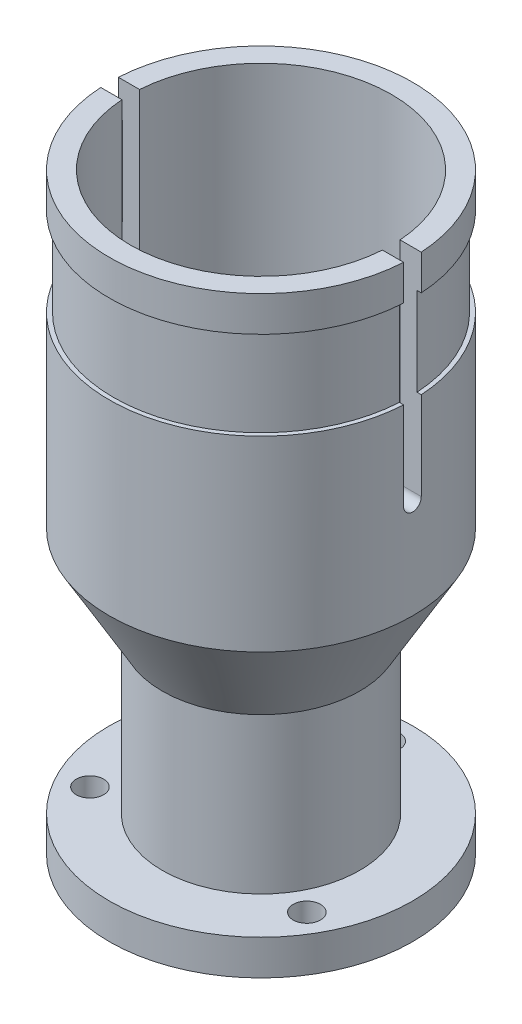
SolidWorks part; units mm, degrees
ref_plane "Front" through (0, 0, 0) normal (0, 0, 1) x (1, 0, 0)
ref_plane "Top" through (0, 0, 0) normal (0, 1, 0) x (1, 0, 0)
ref_plane "Right" through (0, 0, 0) normal (1, 0, 0) x (0, 0, -1)
sketch "Sketch1" plane through (0, 0, 0) normal (0, 0, 1) x (1, 0, 0)
  line L0 (0, 0) -> (0, 86.1729) construction
  line L1 (-27.305, 106.68) -> (-27.305, 100.33)
  line L2 (-27.305, 50.8) -> (-17.78, 34.3022)
  line L3 (-17.78, 34.3022) -> (-17.78, 6.35)
  line L4 (-17.78, 6.35) -> (-27.305, 6.35)
  line L5 (-27.305, 6.35) -> (-27.305, 0)
  line L6 (-27.305, 0) -> (-12.7, 0)
  line L7 (-12.7, 0) -> (-12.7, 55.88)
  line L8 (-12.7, 55.88) -> (-23.495, 55.88)
  line L9 (-23.495, 55.88) -> (-23.495, 106.68)
  line L10 (-23.495, 106.68) -> (-27.305, 106.68)
  line L11 (-27.305, 100.33) -> (-26.543, 100.33)
  line L12 (-26.543, 100.33) -> (-26.543, 84.455)
  line L13 (-26.543, 84.455) -> (-27.305, 84.455)
  line L14 (-27.305, 84.455) -> (-27.305, 50.8)
  dimension "D1" = 5.08
  dimension "D2" = 6.35
  dimension "D3" = 3.81
  dimension "D4" = 5.08
  dimension "D5" = 25.4
  dimension "D6" = 50.8
  dimension "D7" = 55.88
  dimension "D8" = 60
  dimension "D9" = 46.99
  dimension "D10" = 6.35
  dimension "D11" = 15.875
  dimension "D12" = 0.762
revolve "Revolve1" add sketch "Sketch1" angle 360 about L0
sketch "Sketch2" plane through (0, 0, 0) normal (1, 0, 0) x (0, 0, -1)
  line L0 (0, 0) -> (0, 130.3629) construction
  line L1 (0, 68.58) -> (0, 130.3629) construction
  line L2 (-1.5875, 68.58) -> (-1.5875, 130.3629)
  line L3 (1.5875, 68.58) -> (1.5875, 130.3629)
  line L4 (27.305, 106.68) -> (-27.305, 106.68) construction
  arc A0 (-1.5875, 68.58) -> (1.5875, 68.58) centre (0, 68.58) ccw
  arc A1 (1.5875, 130.3629) -> (-1.5875, 130.3629) centre (0, 130.3629) ccw
  point P4 (0, 99.4715)
  dimension "D1" = 3.175
  dimension "D2" = 38.1
extrude "Cut-Extrude1" cut sketch "Sketch2" against normal mid plane 101.6
hole_wizard "#10 (0.1935) Diameter Hole1" positions "Sketch4" profile "Sketch3" hole size "#10" standard "ANSI Inch"
sketch "Sketch4" plane through (0, 6.35, 0) normal (0, 1, 0) x (1, 0, 0)
  line L0 (0, 27.305) -> (0, 17.78) construction
  arc A0 (27.2588, 1.5875) -> (-27.2588, 1.5875) centre (0, 0) ccw construction
  circle A1 centre (0, 0) radius 17.78 construction
  point P0 (0, 22.5425)
  dimension "D1" = 9.525
sketch "Sketch3" plane through (0, 6.35, -22.5425) normal (1, 0, 0) x (0, 0, 1)
  line L0 (0, 0) -> (0, 6.35)
  line L1 (0, 6.35) -> (2.4574, 6.35)
  line L2 (2.4574, 6.35) -> (2.4574, 0)
  line L5 (2.4574, 0) -> (0, 0)
  line L11 (0, -6.35) -> (0, 107.95) construction
  dimension "Thru Hole Dia." = 4.9149
  dimension "Thru Hole Depth" = 6.35
pattern_circular "CirPattern1" count 3 over 360 about axis through (0, 0, 0) along (0, 1, 0) of "#10 (0.1935) Diameter Hole1"
